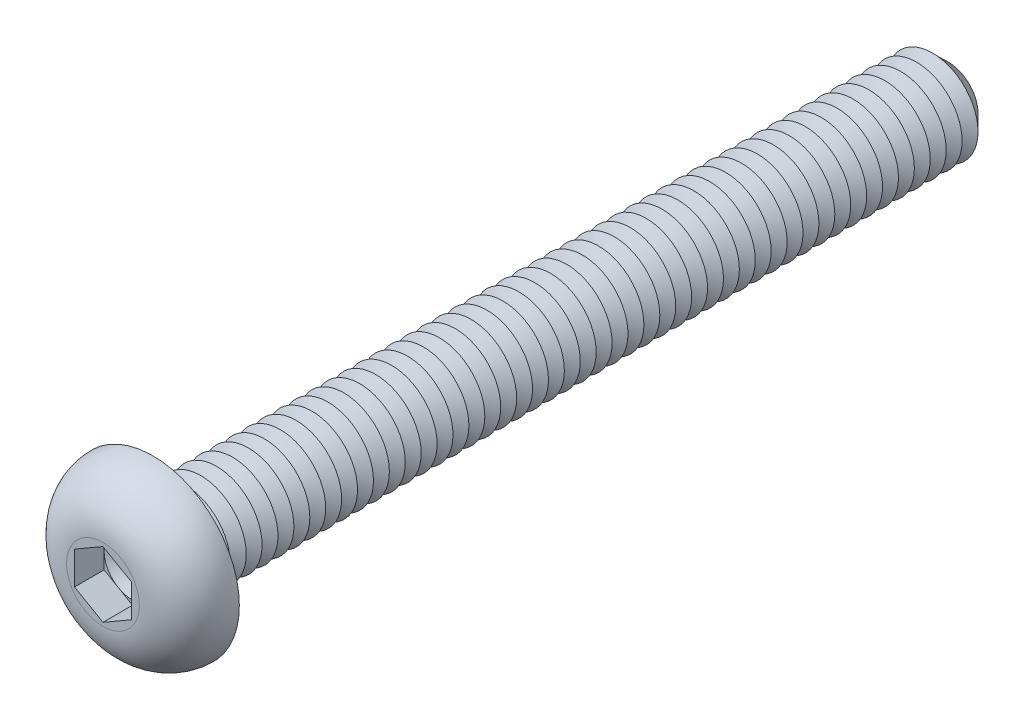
SolidWorks part; units mm, degrees
ref_plane "Front Plane" through (0, 0, 0) normal (0, 0, 1) x (1, 0, 0)
ref_plane "Top Plane" through (0, 0, 0) normal (0, 1, 0) x (1, 0, 0)
ref_plane "Right Plane" through (0, 0, 0) normal (1, 0, 0) x (0, 0, -1)
sketch "Sketch1" plane through (0, 0, 0) normal (1, 0, 0) x (0, 0, -1)
  line L0 (-47.9342, 0) -> (60.3146, 0) construction
sketch "Sketch2" plane through (0, 0, 0) normal (1, 0, 0) x (0, 0, -1)
  line L0 (0, 0) -> (-2.2, 0)
  line L1 (-47.9342, 0) -> (60.3146, 0) construction
  line L2 (-2.2, 0) -> (-2.2, 1.6)
  line L3 (0, 3.8) -> (0, 0)
  arc A0 (-2.2, 1.6) -> (0, 3.8) centre (0, 1.6) cw
  dimension "D1" = 2.2
  dimension "D2" = 2.2
  dimension "D3" = 3.8
revolve "Revolve1" add sketch "Sketch2" angle 360 about L0
sketch "Sketch3" plane through (0, 0, 2.2) normal (0, 0, 1) x (1, 0, 0)
  line L1 (0, 1.4434) -> (-1.25, 0.7217)
  line L2 (-1.25, 0.7217) -> (-1.25, -0.7217)
  line L3 (-1.25, -0.7217) -> (0, -1.4434)
  line L4 (0, -1.4434) -> (1.25, -0.7217)
  line L5 (1.25, -0.7217) -> (1.25, 0.7217)
  line L6 (1.25, 0.7217) -> (0, 1.4434)
  circle A0 centre (0, 0) radius 1.25 construction
  dimension "D1" = 2.5
extrude "Cut-Extrude1" cut sketch "Sketch3" against normal blind 1.3
sketch "Sketch4" plane through (0, 0, 0) normal (0, 0, -1) x (-1, 0, 0)
  circle A0 centre (0, 0) radius 2
  dimension "D1" = 4
extrude "Boss-Extrude1" add sketch "Sketch4" along normal blind 35
chamfer "Chamfer1" distance 0.7 angle 45 1 edges at (-2, 0, -35)
sketch "Sketch5" plane through (0, 0, 0) normal (1, 0, 0) x (0, 0, -1)
  line L0 (0.7, 2) -> (1.4, 2)
  line L1 (34.3, 2) -> (0, 2) construction
  line L2 (1.4, 2) -> (1.05, 1.3938)
  line L3 (1.05, 1.3938) -> (0.7, 2)
  line L4 (0, -3.8) -> (0, 3.8) construction
  line L5 (34.3, 2) -> (0, 2) construction
  dimension "D1" = 0.7
  dimension "D2" = 0.7
revolve "Cut-Revolve1" cut sketch "Sketch5" angle 360 about L0
pattern_linear "LPattern1" count 48 spacing 0.7 along (0, 0, -1) of "Cut-Revolve1"
fillet "Fillet2" radius 0.3 1 edges at (2, 0, 0)
sketch "Sketch6" plane through (0, 0, 0.9) normal (0, 0, 1) x (1, 0, 0)
  line L0 (0, -1.4434) -> (1.25, -0.7217) construction
  circle A0 centre (0, 0) radius 1.25
extrude "Cut-Extrude2" cut sketch "Sketch6" against normal through all draft 60
